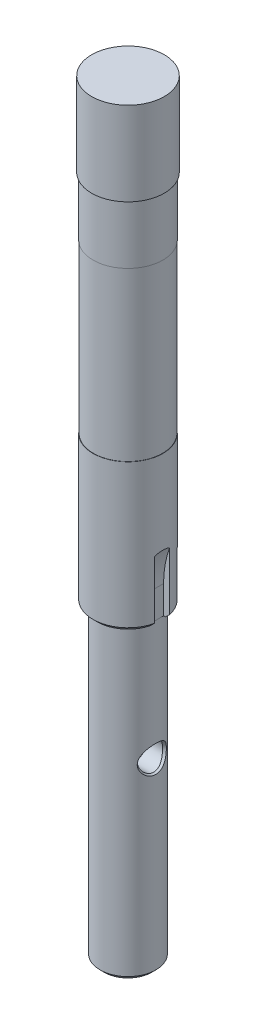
SolidWorks part; units mm, degrees
ref_plane "Plan de face" through (0, 0, 0) normal (0, 0, 1) x (1, 0, 0)
ref_plane "Plan de dessus" through (0, 0, 0) normal (0, 1, 0) x (1, 0, 0)
ref_plane "Plan de droite" through (0, 0, 0) normal (1, 0, 0) x (0, 0, -1)
sketch "Esquisse1" plane through (0, 0, 0) normal (0, 0, 1) x (1, 0, 0)
  line L0 (0, 14.1588) -> (0, -295.5305) construction
  line L1 (0, 0) -> (0, -274)
  line L2 (0, -274) -> (10, -274)
  line L3 (12.5, -164) -> (12.5, -111)
  line L4 (12.5, -111) -> (12.4, -111)
  line L5 (12.4, -111) -> (12.4, -51)
  line L6 (12.4, -51) -> (12.5, -51)
  line L7 (12.5, -51) -> (12.5, -30)
  line L8 (12.5, -30) -> (13, -30)
  line L9 (13, -30) -> (13, 0)
  line L10 (13, 0) -> (0, 0)
  line L11 (10, -274) -> (10, -164)
  line L12 (10, -164) -> (12.5, -164)
  dimension "D1" = 274
  dimension "D2" = 30
  dimension "D3" = 21
  dimension "D4" = 26
  dimension "D5" = 25
  dimension "D6" = 24.8
  dimension "D7" = 60
  dimension "D8" = 110
  dimension "D9" = 20
revolve "Révolution1" add sketch "Esquisse1" angle 360 about L0
chamfer "Chanfrein1" distance 1.5 angle 45 1 edges at (0, -274, 10)
ref_plane "Plan1" through (0, 14.1588, 0) normal (-1, 0, 0) x (0, 0, 1)
ref_plane "Plan2" through (12.5, -137.5, 0) normal (1, 0, 0) x (0, 0, -1)
hole_wizard "Diamètre du perçage Ø9.0 (9)1" positions "Esquisse6" profile "Esquisse5" hole size "Ø9.0" standard "ISO"
sketch "Esquisse6" plane through (12.5, -137.5, 0) normal (1, 0, 0) x (0, 0, -1)
  line L1 (0, 192.5) -> (0, 82.5) construction
  line L2 (-8.5, -136.5) -> (8.5, -136.5) construction
  point P1 (0, -69.5)
  dimension "D1" = 67
sketch "Esquisse5" plane through (12.5, -207, 0) normal (0, 1, 0) x (0, 0, -1)
  line L0 (0, 0) -> (0, 12.7039)
  line L1 (0, 12.7039) -> (4.5, 10)
  line L2 (4.5, 10) -> (4.5, 0)
  line L5 (4.5, 0) -> (0, 0)
  line L10 (0, 12.7039) -> (-4.5, 10) construction
  line L11 (0, -6.35) -> (0, 107.95) construction
  dimension "Diamètre du perçage" = 9
  dimension "Profondeur du perçage" = 10
  dimension "Angle de pointe" = 118
chamfer "Chanfrein2" distance 1 angle 45 1 edges at (8.9487, -206.4259, 4.4632)
chamfer "Chanfrein3" distance 1.5 angle 45 1 edges at (0, -164, 12.5)
sketch "Esquisse7" plane through (0, 0, 0) normal (0, 0, 1) x (1, 0, 0)
  line L0 (10, -164) -> (10, -154)
  line L1 (-11, -164) -> (11, -164) construction
  line L2 (10, -202.1701) -> (10, -164) construction
  line L3 (12.5, -162.5) -> (12.5, -111) construction
  line L4 (12.5, -141.0096) -> (12.5, -164)
  line L5 (12.5, -164) -> (10, -164)
  arc A0 (10, -154) -> (12.5, -141.0096) centre (45, -154) cw
  dimension "D1" = 35
  dimension "D2" = 10
extrude "Extrusion1" cut sketch "Esquisse7" against normal mid plane 5.5
